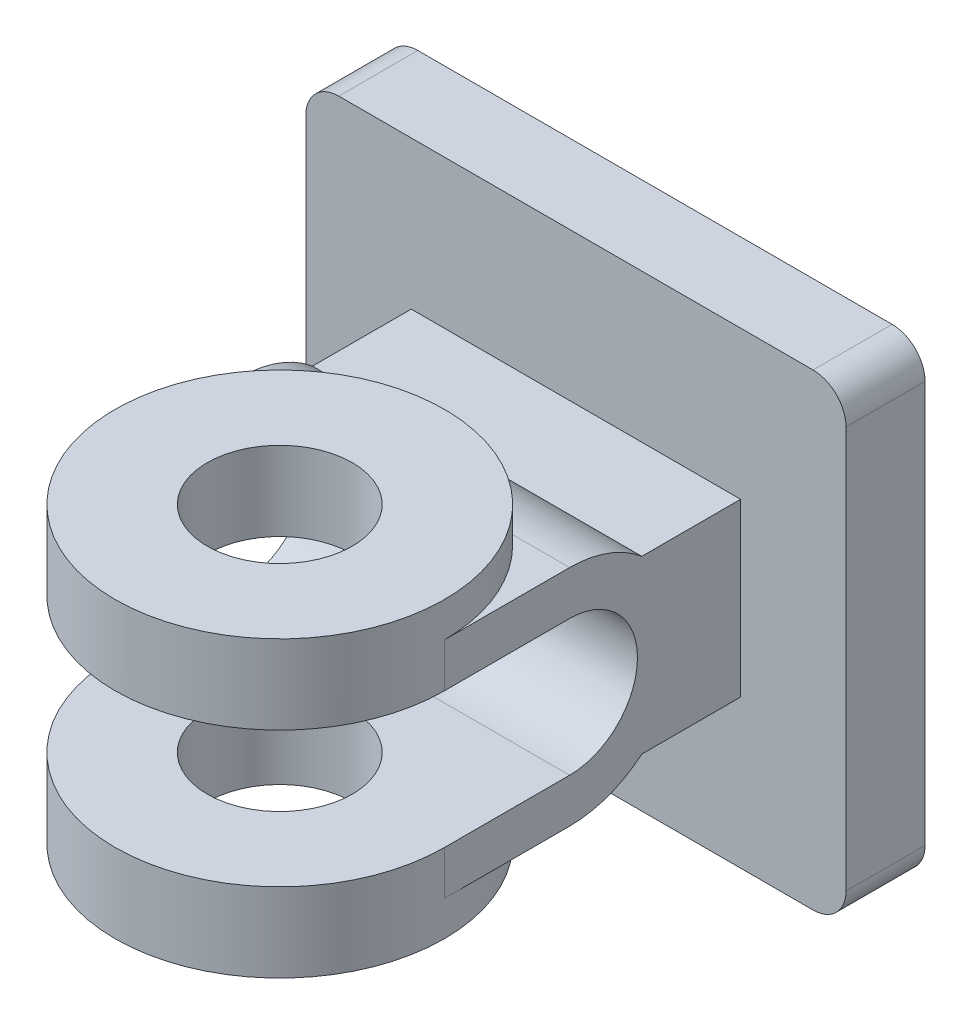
SolidWorks part; units mm, degrees
ref_plane "Front Plane" through (0, 0, 0) normal (0, 0, 1) x (1, 0, 0)
ref_plane "Top Plane" through (0, 0, 0) normal (0, 1, 0) x (1, 0, 0)
ref_plane "Right Plane" through (0, 0, 0) normal (1, 0, 0) x (0, 0, -1)
sketch "Sketch1" plane through (0, 0, 0) normal (1, 0, 0) x (0, 0, -1)
  line L0 (-19, 10.3) -> (-19, -17) construction
  line L1 (10.9545, 13) -> (25.9545, 13)
  line L3 (10.9545, -13) -> (25.9545, -13)
  line L4 (25.9545, 13) -> (25.9545, -13)
  line L5 (0, 17) -> (-19, 17)
  line L9 (25.9545, 2) -> (26.6958, 2) construction
  line L10 (0, -17) -> (-19, -17)
  line L11 (0, 10.3) -> (-19, 10.3)
  line L12 (-19, 10.3) -> (-19, 17)
  line L13 (0, -10.3) -> (-19, -10.3)
  line L14 (-19, -10.3) -> (-19, -17)
  line L15 (0, 0) -> (25.9545, 0) construction
  arc A1 (0, -10.3) -> (0, 10.3) centre (0, 0) ccw
  arc A2 (0, -17) -> (10.9545, -13) centre (0, 0) ccw
  arc A3 (10.9545, 13) -> (0, 17) centre (0, 0) ccw
  point P14 (18.4545, -13)
  dimension "D1" = 15
  dimension "D2" = 20.6
  dimension "D5" = 17
  dimension "D3" = 13
  dimension "D4" = 19
  dimension "D6" = 13
extrude "Boss-Extrude1" add sketch "Sketch1" along normal mid plane 50
sketch "Sketch2" plane through (0, -10.3, 0) normal (0, 1, 0) x (1, 0, 0)
  line L0 (25, -19) -> (-25, -19) construction
  circle A0 centre (0, -19) radius 25
  dimension "D1" = 50
extrude "Boss-Extrude2" add sketch "Sketch2" against normal blind 12
sketch "Sketch3" plane through (0, -10.3, 0) normal (0, 1, 0) x (1, 0, 0)
  line L0 (25, -19) -> (-25, -19) construction
  circle A0 centre (0, -19) radius 11
  dimension "D1" = 22
extrude "Cut-Extrude1" cut sketch "Sketch3" against normal blind 26
mirror "Mirror2" about plane through (0, 0, 0) normal (0, 1, 0) of "Cut-Extrude1", "Boss-Extrude2"
sketch "Sketch4" plane through (0, 0, -25.9545) normal (0, 0, -1) x (-1, 0, 0)
  line L1 (-41, -35.5) -> (41, -35.5)
  line L2 (-41, -35.5) -> (-41, 35.5)
  line L3 (-41, 35.5) -> (41, 35.5)
  line L4 (41, -35.5) -> (41, 35.5)
  line L5 (-41, -35.5) -> (41, 35.5) construction
  line L6 (-41, 35.5) -> (41, -35.5) construction
  point P0 (0, 0)
  dimension "D1" = 71
  dimension "D2" = 82
extrude "Boss-Extrude3" add sketch "Sketch4" along normal blind 12
fillet "Fillet1" radius 5 4 edges at (-41, -35.5, -31.9545) (41, -35.5, -31.9545) (41, 35.5, -31.9545) (-41, 35.5, -31.9545)
scale "Scale1" scale about centroid uniform scaling yes scale factor 0.7
scale "Scale2" scale about centroid uniform scaling yes scale factor 0.5
scale "Scale3" scale about centroid uniform scaling yes scale factor 1.25
ref_plane "Plane2" through (0, 0, 0) normal (-1, 0, 0) x (0, 0, 1)
